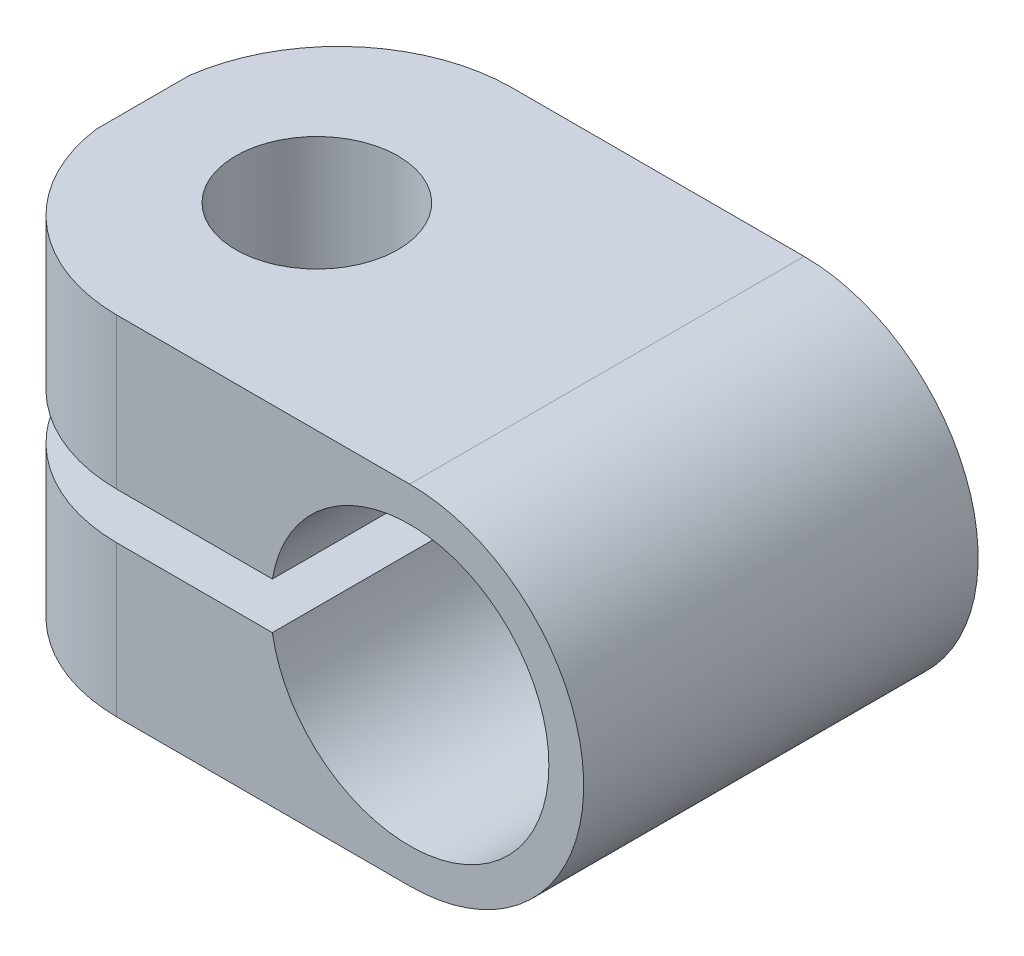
SolidWorks part; units mm, degrees
ref_plane "Face" through (0, 0, 0) normal (0, 0, 1) x (1, 0, 0)
ref_plane "Dessus" through (0, 0, 0) normal (0, 1, 0) x (1, 0, 0)
ref_plane "Droite" through (0, 0, 0) normal (1, 0, 0) x (0, 0, -1)
sketch "Esquisse1" plane through (0, 0, 0) normal (0, 0, 1) x (1, 0, 0)
  line L0 (0, 0) -> (0, 15)
  line L1 (0, 15) -> (20, 15)
  line L2 (0, 0) -> (20, 0)
  arc A0 (20, 15) -> (20, 0) centre (20, 7.5) cw
  dimension "D1" = 15
  dimension "D2" = 20
extrude "Extrusion1" add sketch "Esquisse1" along normal blind 17
sketch "Esquisse2" plane through (0, 0, 17) normal (0, 0, 1) x (1, 0, 0)
  circle A0 centre (20, 7.5) radius 6
  arc A1 (20, 0) -> (20, 15) centre (20, 7.5) ccw construction
  dimension "D1" = 12
extrude "Enlèv. mat.-Extru.1" cut sketch "Esquisse2" against normal through all
sketch "Esquisse3" plane through (0, 0, 17) normal (0, 0, 1) x (1, 0, 0)
  line L0 (0, 8.5) -> (16.4364, 8.5)
  line L1 (0, 15) -> (0, 0) construction
  line L2 (16.4364, 8.5) -> (16.4364, 6.5)
  line L3 (16.4364, 6.5) -> (0, 6.5)
  line L4 (0, 8.5) -> (0, 6.5)
  line L5 (20, 15) -> (0, 15) construction
  circle A0 centre (20, 7.5) radius 6 construction
  dimension "D3" = 3.5636
  dimension "D1" = 2
  dimension "D2" = 6.5
extrude "Enlèv. mat.-Extru.2" cut sketch "Esquisse3" against normal through all
sketch "Esquisse4" plane through (0, 0, 0) normal (0, -1, 0) x (1, 0, 0)
  line L0 (7.5, 17) -> (7.5, 18.2897)
  line L1 (0, 17) -> (20, 17) construction
  line L2 (7.5, 18.2897) -> (-1.2323, 18.2897)
  line L3 (0, 17) -> (0, 0) construction
  line L4 (-1.2323, 18.2897) -> (-1.2323, -1.2897)
  line L6 (-2.1858, 8.5) -> (24.5111, 8.5) construction
  line L7 (7.5, 0) -> (7.5, -1.2897)
  line L8 (7.5, -1.2897) -> (-1.2323, -1.2897)
  arc A0 (7.5, 17) -> (0, 8.5) centre (7.433, 9.5003) ccw
  arc A1 (7.5, 0) -> (0, 8.5) centre (7.433, 7.4997) cw
  dimension "D2" = 7.5
extrude "Enlèv. mat.-Extru.5" cut sketch "Esquisse4" against normal through all
sketch "Esquisse7" plane through (0, 0, 0) normal (0, -1, 0) x (1, 0, 0)
  line L0 (0, 10.5006) -> (0, 6.4994) construction
  line L1 (7.366, 0) -> (20, 0) construction
  circle A0 centre (7.5, 8.5) radius 3.5
  dimension "D3" = 7
  dimension "D1" = 7.5
  dimension "D2" = 8.5
extrude "Enlèv. mat.-Extru.6" cut sketch "Esquisse7" against normal through all
